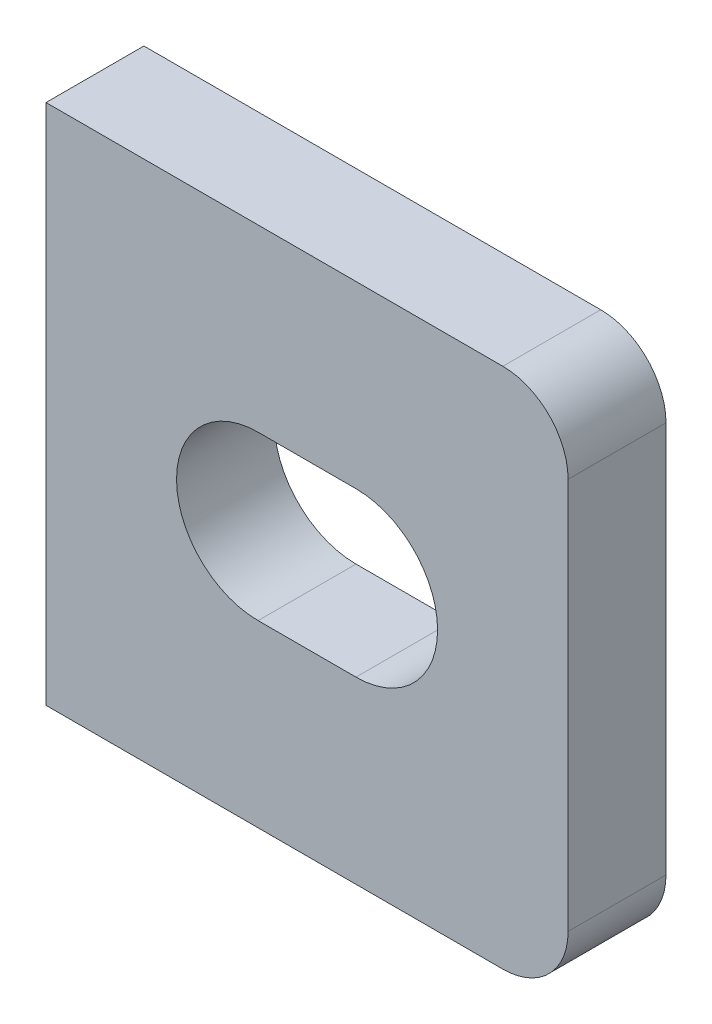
SolidWorks part; units mm, degrees
ref_plane "FRONT" through (0, 0, 0) normal (0, 0, 1) x (1, 0, 0)
ref_plane "TOP" through (0, 0, 0) normal (0, 1, 0) x (1, 0, 0)
ref_plane "RIGHT" through (0, 0, 0) normal (1, 0, 0) x (0, 0, -1)
sketch "Sketch1" plane through (0, 0, 0) normal (0, 0, 1) x (1, 0, 0)
  line L0 (0, 0) -> (44.45, 0)
  line L1 (50.8, 6.35) -> (50.8, 44.45)
  line L2 (44.45, 50.8) -> (0, 50.8)
  line L3 (0, 50.8) -> (0, 0)
  line L4 (30.1625, 33.3375) -> (20.6375, 33.3375)
  line L5 (20.6375, 17.4625) -> (30.1625, 17.4625)
  line L6 (7.2719, 25.4) -> (44.45, 25.4) construction
  arc A0 (44.45, 0) -> (50.8, 6.35) centre (44.45, 6.35) ccw
  arc A1 (50.8, 44.45) -> (44.45, 50.8) centre (44.45, 44.45) ccw
  arc A2 (20.6375, 33.3375) -> (20.6375, 17.4625) centre (20.6375, 25.4) ccw
  arc A3 (30.1625, 17.4625) -> (30.1625, 33.3375) centre (30.1625, 25.4) ccw
  dimension "D2" = 6.35
  dimension "D6" = 7.9375
  dimension "D1" = 50.8
  dimension "D3" = 50.8
  dimension "D4" = 20.6375
  dimension "D5" = 9.525
sheet metal parameters "Sheet-Metal1" thickness 9.525 parameters "D1"=4.7625
base flange "Base-Flange1" sketch "Sketch1" thickness 9.525 reverse thickness direction no parameters "D1"=4.7625
flat pattern "Flat-Pattern1"
sketch "Bend-Lines1" plane through (0, 0, 0) normal (0, 1, 0) x (-1, 0, 0)
